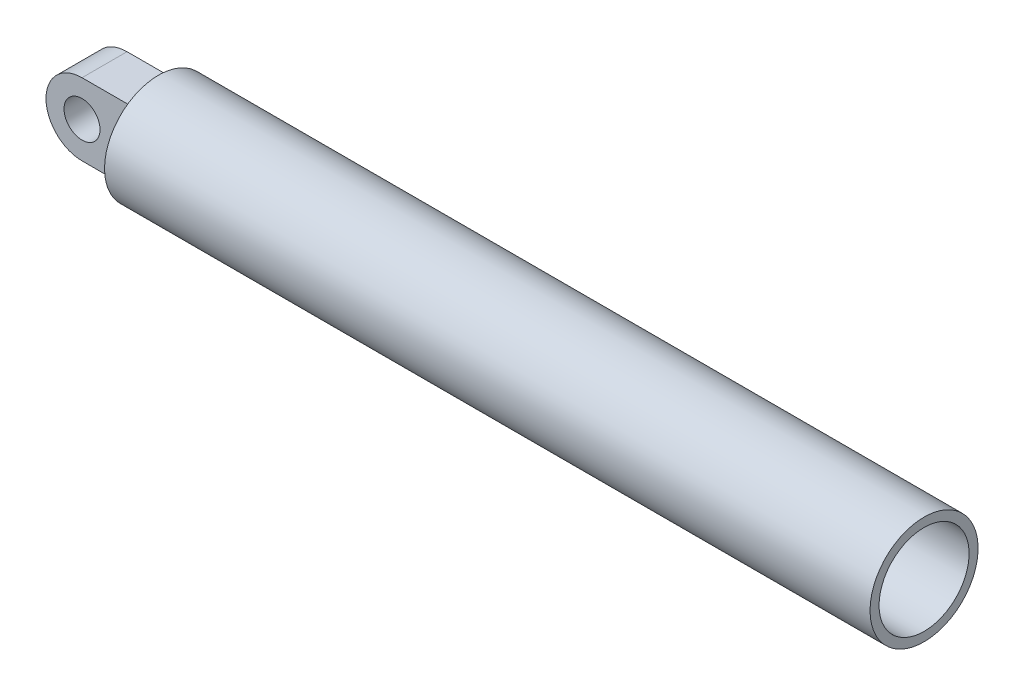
SolidWorks part; units mm, degrees
ref_plane "Plane1" through (0, 0, 0) normal (0, 0, 1) x (1, 0, 0)
ref_plane "Plane2" through (0, 0, 0) normal (0, 1, 0) x (1, 0, 0)
ref_plane "Plane3" through (0, 0, 0) normal (1, 0, 0) x (0, 0, -1)
sketch "Sketch1" plane through (0, 0, 0) normal (0, 0, 1) x (1, 0, 0)
  line L0 (0, 0) -> (0, 60)
  line L1 (0, 60) -> (850, 60)
  line L2 (850, 60) -> (850, 50)
  line L3 (850, 50) -> (25, 50)
  line L4 (0, 0) -> (25, 0)
  line L5 (25, 0) -> (25, 50)
  line L6 (0, 0) -> (130, 0) construction
  dimension "D1" = 25
  dimension "D2" = 60
  dimension "D3" = 10
  dimension "D4" = 850
revolve "Base-Revolve" add sketch "Sketch1" angle 360 about L6
sketch "Sketch2" plane through (0, 0, 0) normal (0, 0, 1) x (1, 0, 0)
  line L0 (-60, 40) -> (0, 40)
  line L1 (-60, -40) -> (0, -40)
  line L2 (0, 60) -> (0, -60) construction
  line L3 (0, -40) -> (0, 40)
  arc A0 (-60, 40) -> (-60, -40) centre (-60, 0) ccw
  circle A1 centre (-60, 0) radius 20
  dimension "D1" = 40
  dimension "D3" = 40
  dimension "D2" = 60
extrude "Boss-Extrude1" add sketch "Sketch2" along normal mid plane 50
ref_point "Point1"
ref_point "Point2"
